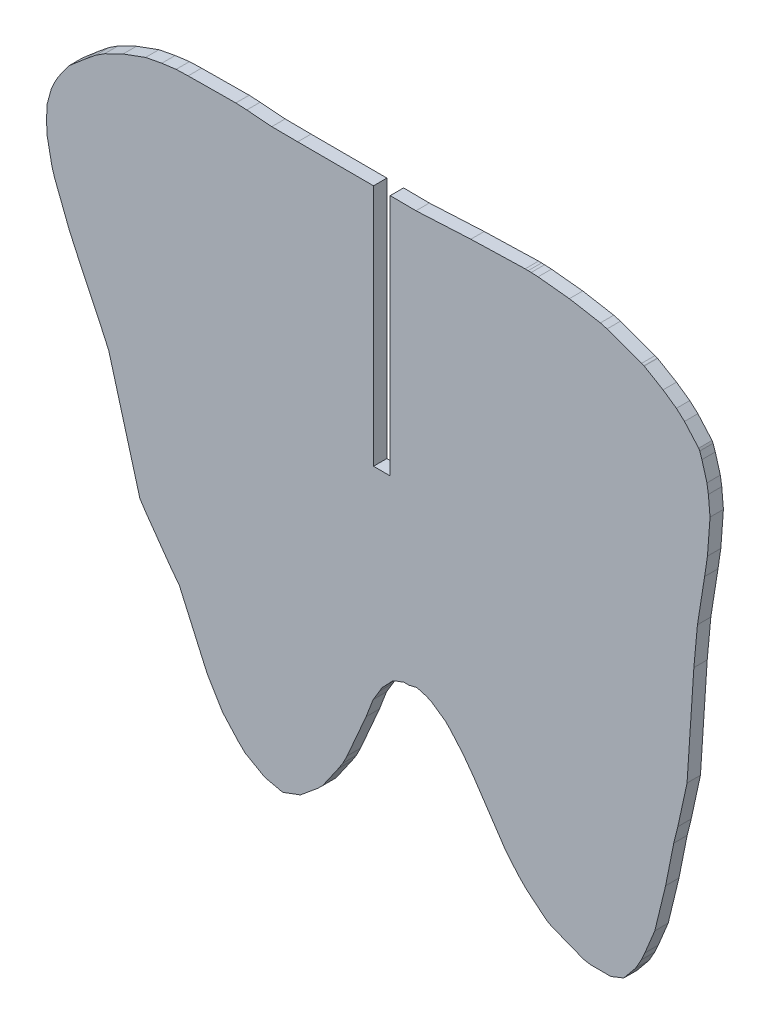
SolidWorks part; units mm, degrees
ref_plane "Спереди" through (0, 0, 0) normal (0, 0, 1) x (1, 0, 0)
ref_plane "Сверху" through (0, 0, 0) normal (0, 1, 0) x (1, 0, 0)
ref_plane "Справа" through (0, 0, 0) normal (1, 0, 0) x (0, 0, -1)
sketch "Model" plane through (0, 0, 0) normal (0, 0, 1) x (1, 0, 0)
  line L0 (-5853.0245, 159.3657) -> (-5855.8444, 161.036)
  line L1 (-5855.8444, 161.036) -> (-5855.8894, 161.0573)
  line L2 (-5855.8894, 161.0573) -> (-5856.2394, 161.1905)
  line L3 (-5856.2394, 161.1905) -> (-5861.403, 163.0673)
  line L4 (-5861.403, 163.0673) -> (-5862.399, 163.3504)
  line L5 (-5862.399, 163.3504) -> (-5867.0375, 164.1654)
  line L6 (-5867.0375, 164.1654) -> (-5871.7121, 164.6539)
  line L7 (-5871.7121, 164.6539) -> (-5872.7494, 164.7031)
  line L8 (-5872.7494, 164.7031) -> (-5873.195, 164.7166)
  line L9 (-5873.195, 164.7166) -> (-5873.6407, 164.7302)
  line L10 (-5873.6407, 164.7302) -> (-5881.7724, 164.4992)
  line L11 (-5881.7724, 164.4992) -> (-5889.9709, 164.0833)
  line L12 (-5889.9709, 164.0833) -> (-5893.822, 164.1198)
  line L13 (-5893.822, 164.1198) -> (-5893.822, 127.8223)
  line L14 (-5893.822, 127.8223) -> (-5894.072, 127.8223)
  line L15 (-5894.072, 127.8223) -> (-5896.072, 127.8223)
  line L16 (-5896.072, 127.8223) -> (-5896.322, 127.8223)
  line L17 (-5896.322, 127.8223) -> (-5896.322, 164.1412)
  line L18 (-5896.322, 164.1412) -> (-5907.6613, 164.1685)
  line L19 (-5907.6613, 164.1685) -> (-5911.5273, 164.1981)
  line L20 (-5911.5273, 164.1981) -> (-5915.2686, 164.4894)
  line L21 (-5915.2686, 164.4894) -> (-5916.9083, 164.5766)
  line L22 (-5916.9083, 164.5766) -> (-5924.0391, 164.5159)
  line L23 (-5924.0391, 164.5159) -> (-5925.8358, 164.4639)
  line L24 (-5925.8358, 164.4639) -> (-5927.9769, 164.1839)
  line L25 (-5927.9769, 164.1839) -> (-5930.4005, 163.7235)
  line L26 (-5930.4005, 163.7235) -> (-5933.7527, 162.4948)
  line L27 (-5933.7527, 162.4948) -> (-5936.5193, 161.143)
  line L28 (-5936.5193, 161.143) -> (-5937.86, 160.2812)
  line L29 (-5937.86, 160.2812) -> (-5939.4629, 158.9738)
  line L30 (-5939.4629, 158.9738) -> (-5941.8194, 156.9559)
  line L31 (-5941.8194, 156.9559) -> (-5943.4365, 154.7165)
  line L32 (-5943.4365, 154.7165) -> (-5943.9919, 153.7275)
  line L33 (-5943.9919, 153.7275) -> (-5944.5191, 152.5181)
  line L34 (-5944.5191, 152.5181) -> (-5945.1427, 150.237)
  line L35 (-5945.1427, 150.237) -> (-5945.2005, 148.1909)
  line L36 (-5945.2005, 148.1909) -> (-5945.1408, 146.3424)
  line L37 (-5945.1408, 146.3424) -> (-5944.3987, 142.6154)
  line L38 (-5944.3987, 142.6154) -> (-5944.0117, 141.35)
  line L39 (-5944.0117, 141.35) -> (-5941.7901, 135.6252)
  line L40 (-5941.7901, 135.6252) -> (-5940.0094, 131.7446)
  line L41 (-5940.0094, 131.7446) -> (-5936.8919, 125.1835)
  line L42 (-5936.8919, 125.1835) -> (-5935.9087, 123.0169)
  line L43 (-5935.9087, 123.0169) -> (-5931.2545, 106.1937)
  line L44 (-5931.2545, 106.1937) -> (-5930.298, 104.7421)
  line L45 (-5930.298, 104.7421) -> (-5926.541, 99.4409)
  line L46 (-5926.541, 99.4409) -> (-5925.3628, 97.9178)
  line L47 (-5925.3628, 97.9178) -> (-5924.5741, 96.1359)
  line L48 (-5924.5741, 96.1359) -> (-5921.2292, 88.621)
  line L49 (-5921.2292, 88.621) -> (-5921.0174, 88.2528)
  line L50 (-5921.0174, 88.2528) -> (-5920.8058, 87.8845)
  line L51 (-5920.8058, 87.8845) -> (-5918.8544, 84.6556)
  line L52 (-5918.8544, 84.6556) -> (-5916.4716, 82.0192)
  line L53 (-5916.4716, 82.0192) -> (-5915.4337, 81.03)
  line L54 (-5915.4337, 81.03) -> (-5915.3044, 80.9686)
  line L55 (-5915.3044, 80.9686) -> (-5915.1751, 80.9071)
  line L56 (-5915.1751, 80.9071) -> (-5912.6522, 79.463)
  line L57 (-5912.6522, 79.463) -> (-5912.3166, 79.3609)
  line L58 (-5912.3166, 79.3609) -> (-5909.9347, 78.8242)
  line L59 (-5909.9347, 78.8242) -> (-5909.8882, 78.8308)
  line L60 (-5909.8882, 78.8308) -> (-5909.8416, 78.8373)
  line L61 (-5909.8416, 78.8373) -> (-5907.2505, 79.8009)
  line L62 (-5907.2505, 79.8009) -> (-5904.657, 81.9561)
  line L63 (-5904.657, 81.9561) -> (-5903.9289, 82.6667)
  line L64 (-5903.9289, 82.6667) -> (-5901.5328, 86.1057)
  line L65 (-5901.5328, 86.1057) -> (-5900.8872, 87.1126)
  line L66 (-5900.8872, 87.1126) -> (-5900.266, 88.3421)
  line L67 (-5900.266, 88.3421) -> (-5897.431, 94.8424)
  line L68 (-5897.431, 94.8424) -> (-5896.3836, 97.5712)
  line L69 (-5896.3836, 97.5712) -> (-5895.4067, 99.1826)
  line L70 (-5895.4067, 99.1826) -> (-5895.0661, 99.7713)
  line L71 (-5895.0661, 99.7713) -> (-5893.9303, 100.9517)
  line L72 (-5893.9303, 100.9517) -> (-5893.5522, 101.367)
  line L73 (-5893.5522, 101.367) -> (-5893.0344, 101.6905)
  line L74 (-5893.0344, 101.6905) -> (-5892.5293, 101.8322)
  line L75 (-5892.5293, 101.8322) -> (-5892.1706, 101.9899)
  line L76 (-5892.1706, 101.9899) -> (-5891.8119, 102.1476)
  line L77 (-5891.8119, 102.1476) -> (-5891.0721, 102.1093)
  line L78 (-5891.0721, 102.1093) -> (-5890.4536, 102.2608)
  line L79 (-5890.4536, 102.2608) -> (-5889.8352, 102.4124)
  line L80 (-5889.8352, 102.4124) -> (-5888.3773, 101.9886)
  line L81 (-5888.3773, 101.9886) -> (-5887.596, 101.6126)
  line L82 (-5887.596, 101.6126) -> (-5885.5885, 100.2136)
  line L83 (-5885.5885, 100.2136) -> (-5884.8441, 99.4617)
  line L84 (-5884.8441, 99.4617) -> (-5882.9702, 97.3084)
  line L85 (-5882.9702, 97.3084) -> (-5881.3833, 95.146)
  line L86 (-5881.3833, 95.146) -> (-5876.5685, 87.9604)
  line L87 (-5876.5685, 87.9604) -> (-5874.7292, 85.7665)
  line L88 (-5874.7292, 85.7665) -> (-5873.4773, 84.4862)
  line L89 (-5873.4773, 84.4862) -> (-5870.4433, 81.979)
  line L90 (-5870.4433, 81.979) -> (-5870.2578, 81.8681)
  line L91 (-5870.2578, 81.8681) -> (-5870.0722, 81.7573)
  line L92 (-5870.0722, 81.7573) -> (-5869.5061, 81.4941)
  line L93 (-5869.5061, 81.4941) -> (-5864.8581, 79.6733)
  line L94 (-5864.8581, 79.6733) -> (-5864.328, 79.5872)
  line L95 (-5864.328, 79.5872) -> (-5863.7978, 79.5012)
  line L96 (-5863.7978, 79.5012) -> (-5863.2833, 79.5045)
  line L97 (-5863.2833, 79.5045) -> (-5862.7688, 79.5076)
  line L98 (-5862.7688, 79.5076) -> (-5860.8335, 79.5003)
  line L99 (-5860.8335, 79.5003) -> (-5858.8993, 80.2709)
  line L100 (-5858.8993, 80.2709) -> (-5858.8957, 80.2739)
  line L101 (-5858.8957, 80.2739) -> (-5858.8921, 80.2767)
  line L102 (-5858.8921, 80.2767) -> (-5857.1284, 82.4362)
  line L103 (-5857.1284, 82.4362) -> (-5856.2594, 83.9606)
  line L104 (-5856.2594, 83.9606) -> (-5855.7518, 85.0887)
  line L105 (-5855.7518, 85.0887) -> (-5854.259, 88.7011)
  line L106 (-5854.259, 88.7011) -> (-5852.6482, 95.3437)
  line L107 (-5852.6482, 95.3437) -> (-5851.4267, 101.4708)
  line L108 (-5851.4267, 101.4708) -> (-5850.818, 103.9102)
  line L109 (-5850.818, 103.9102) -> (-5849.4389, 110.2574)
  line L110 (-5849.4389, 110.2574) -> (-5848.4237, 125.7003)
  line L111 (-5848.4237, 125.7003) -> (-5847.8853, 131.5126)
  line L112 (-5847.8853, 131.5126) -> (-5846.8141, 138.2993)
  line L113 (-5846.8141, 138.2993) -> (-5846.3901, 141.153)
  line L114 (-5846.3901, 141.153) -> (-5846.0045, 146.3994)
  line L115 (-5846.0045, 146.3994) -> (-5846.2518, 149.2224)
  line L116 (-5846.2518, 149.2224) -> (-5846.4668, 150.6058)
  line L117 (-5846.4668, 150.6058) -> (-5847.2173, 153.2288)
  line L118 (-5847.2173, 153.2288) -> (-5847.5418, 154.1922)
  line L119 (-5847.5418, 154.1922) -> (-5847.7074, 154.4768)
  line L120 (-5847.7074, 154.4768) -> (-5849.8239, 156.8854)
  line L121 (-5849.8239, 156.8854) -> (-5851.0363, 157.9733)
  line L122 (-5851.0363, 157.9733) -> (-5853.0245, 159.3657)
extrude "Бобышка-Вытянуть1" add sketch "Model" along normal blind 2
